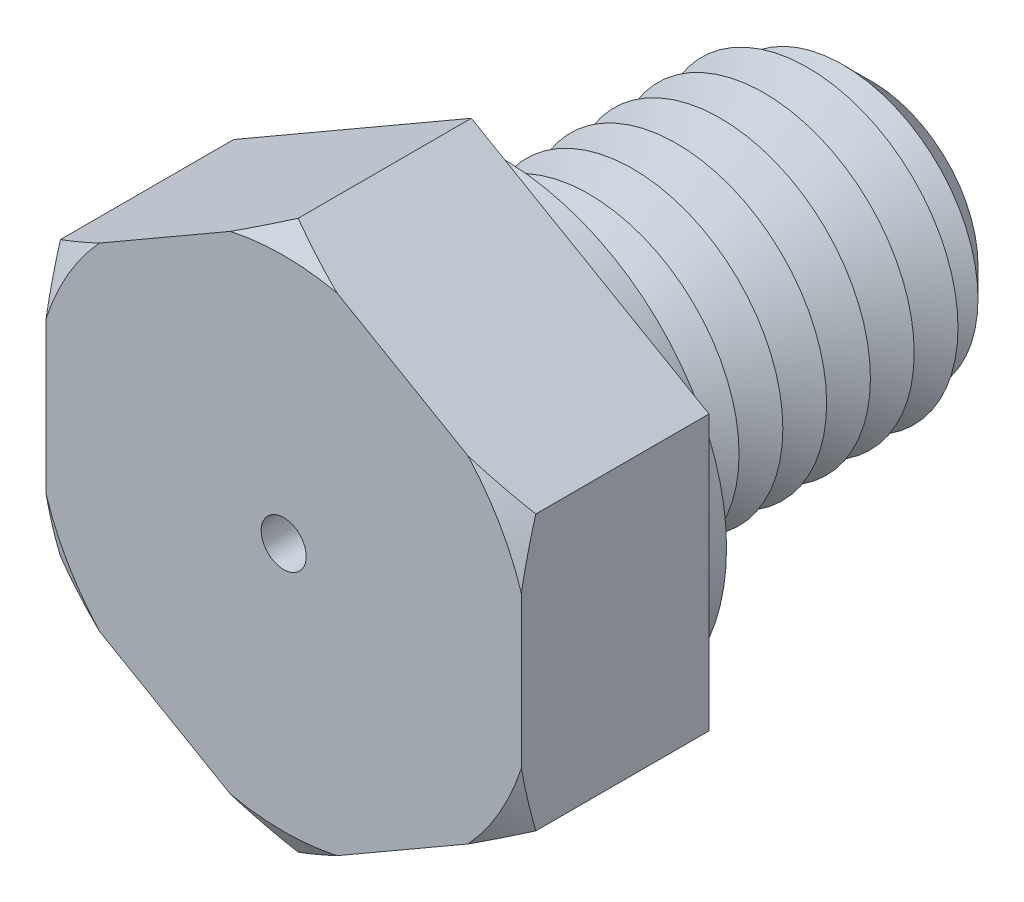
SolidWorks part; units mm, degrees
ref_plane "Front Plane" through (0, 0, 0) normal (0, 0, 1) x (1, 0, 0)
ref_plane "Top Plane" through (0, 0, 0) normal (0, 1, 0) x (1, 0, 0)
ref_plane "Right Plane" through (0, 0, 0) normal (1, 0, 0) x (0, 0, -1)
sketch "Sketch2" plane through (0, 0, 0) normal (0, 0, 1) x (1, 0, 0)
  line L1 (0, 10.9697) -> (-9.5, 5.4848)
  line L2 (-9.5, 5.4848) -> (-9.5, -5.4848)
  line L3 (-9.5, -5.4848) -> (0, -10.9697)
  line L4 (0, -10.9697) -> (9.5, -5.4848)
  line L5 (9.5, -5.4848) -> (9.5, 5.4848)
  line L6 (9.5, 5.4848) -> (0, 10.9697)
  circle A0 centre (0, 0) radius 9.5 construction
  dimension "D1" = 19
extrude "Boss-Extrude1" add sketch "Sketch2" along normal blind 7.5
sketch "Sketch3" plane through (0, 0, 0) normal (0, 0, -1) x (-1, 0, 0)
  circle A0 centre (0, 0) radius 6
  dimension "D1" = 12
extrude "Boss-Extrude2" add sketch "Sketch3" along normal blind 16
sketch "Sketch4" plane through (0, 0, 0) normal (0, 0, -1) x (-1, 0, 0)
  circle A0 centre (0, 0) radius 9
  dimension "D1" = 18
extrude "Boss-Extrude3" add sketch "Sketch4" along normal blind 1.2
sketch "Sketch5" plane through (0, 0, 0) normal (1, 0, 0) x (0, 0, -1)
  line L0 (-3.2117, 0) -> (6.3192, 0) construction
chamfer "Chamfer1" distance 1.75 angle 45 1 edges at (-6, 0, -16)
sketch "Sketch6" plane through (0, 0, 0) normal (1, 0, 0) x (0, 0, -1)
  line L0 (1.2, 6) -> (2.075, 4.4845)
  line L1 (2.075, 4.4845) -> (2.95, 6)
  line L2 (14.25, 6) -> (1.2, 6) construction
  line L3 (2.95, 6) -> (1.2, 6)
  dimension "D1" = 1.75
revolve "Cut-Revolve1" cut sketch "Sketch6" angle 360 about L0
pattern_linear "LPattern1" count 8 spacing 1.75 along (0, 0, -1) of "Cut-Revolve1"
sketch "Sketch7" plane through (0, 0, 0) normal (1, 0, 0) x (0, 0, -1)
  line L0 (-7.5, 10.9697) -> (-7.5, 9.9697)
  line L1 (-7.5, 5.4848) -> (-7.5, 10.9697) construction
  line L2 (-7.5, 9.9697) -> (-6.9226, 10.9697)
  line L3 (-7.5, 10.9697) -> (0, 10.9697) construction
  line L4 (-6.9226, 10.9697) -> (-7.5, 10.9697)
  dimension "D1" = 1
  dimension "D2" = 30
revolve "Cut-Revolve2" cut sketch "Sketch7" angle 360 about L0
sketch "Sketch8" plane through (0, 0, 7.5) normal (0, 0, 1) x (1, 0, 0)
  circle A0 centre (0, 0) radius 0.9
  dimension "D1" = 1.8
extrude "Cut-Extrude1" cut sketch "Sketch8" against normal up to surface (23.5 mm away)
